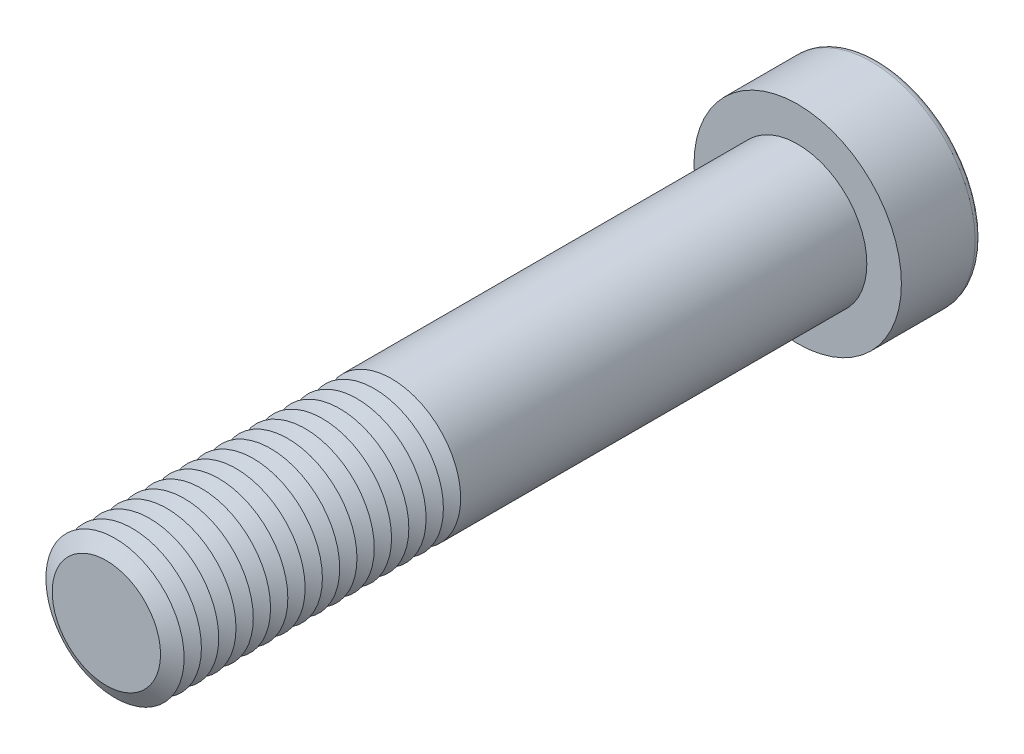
SolidWorks part; units mm, degrees
ref_plane "Front Plane" through (0, 0, 0) normal (0, 0, 1) x (1, 0, 0)
ref_plane "Top Plane" through (0, 0, 0) normal (0, 1, 0) x (1, 0, 0)
ref_plane "Right Plane" through (0, 0, 0) normal (1, 0, 0) x (0, 0, -1)
sketch "Sketch1" plane through (0, 0, 0) normal (0, 0, 1) x (1, 0, 0)
  circle A0 centre (0, 0) radius 12
  dimension "D1" = 24
extrude "Boss-Extrude1" add sketch "Sketch1" along normal blind 120
sketch "Sketch2" plane through (0, 0, 0) normal (0, 0, -1) x (-1, 0, 0)
  circle A0 centre (0, 0) radius 18
  dimension "D1" = 36
extrude "Boss-Extrude2" add sketch "Sketch2" along normal blind 14
sketch "Sketch3" plane through (0, 0, -14) normal (0, 0, -1) x (-1, 0, 0)
  line L1 (-5.4848, 9.5) -> (-10.9697, 0)
  line L2 (-10.9697, 0) -> (-5.4848, -9.5)
  line L3 (-5.4848, -9.5) -> (5.4848, -9.5)
  line L4 (5.4848, -9.5) -> (10.9697, 0)
  line L5 (10.9697, 0) -> (5.4848, 9.5)
  line L6 (5.4848, 9.5) -> (-5.4848, 9.5)
  circle A0 centre (0, 0) radius 9.5 construction
  dimension "D1" = 19
extrude "Cut-Extrude1" cut sketch "Sketch3" against normal blind 14.25
fillet "Fillet1" radius 1.2 1 edges at (-18, 0, -14)
sketch "Sketch4" plane through (0, 0, 0.25) normal (0, 0, -1) x (-1, 0, 0)
  line L0 (5.4848, -9.5) -> (10.9697, 0) construction
  circle A0 centre (0, 0) radius 9.5
extrude "Cut-Extrude2" cut sketch "Sketch4" against normal through all draft 60
sketch "Sketch5" plane through (0, 0, -14) normal (0, 0, -1) x (-1, 0, 0)
  circle A0 centre (0, 0) radius 10.9697
extrude "Cut-Extrude3" cut sketch "Sketch5" against normal through all draft 75
sketch "Sketch7" plane through (0, 0, 0) normal (1, 0, 0) x (0, 0, -1)
  line L25 (-120, 9.4019) -> (-118.5, 12)
  line L26 (-120, 12) -> (-120, -12) construction
  line L27 (-118.5, 12) -> (-121.5, 12)
  line L28 (-121.5, 12) -> (-120, 9.4019)
  line L29 (0, 12) -> (-120, 12) construction
  dimension "D1" = 3
revolve "Cut-Revolve1" cut sketch "Sketch7" angle 360 about axis through (0, 0, 120) along (0, 0, -1)
pattern_linear "LPattern1" count 17 spacing 3 along (0, 0, -1) of "Cut-Revolve1"
